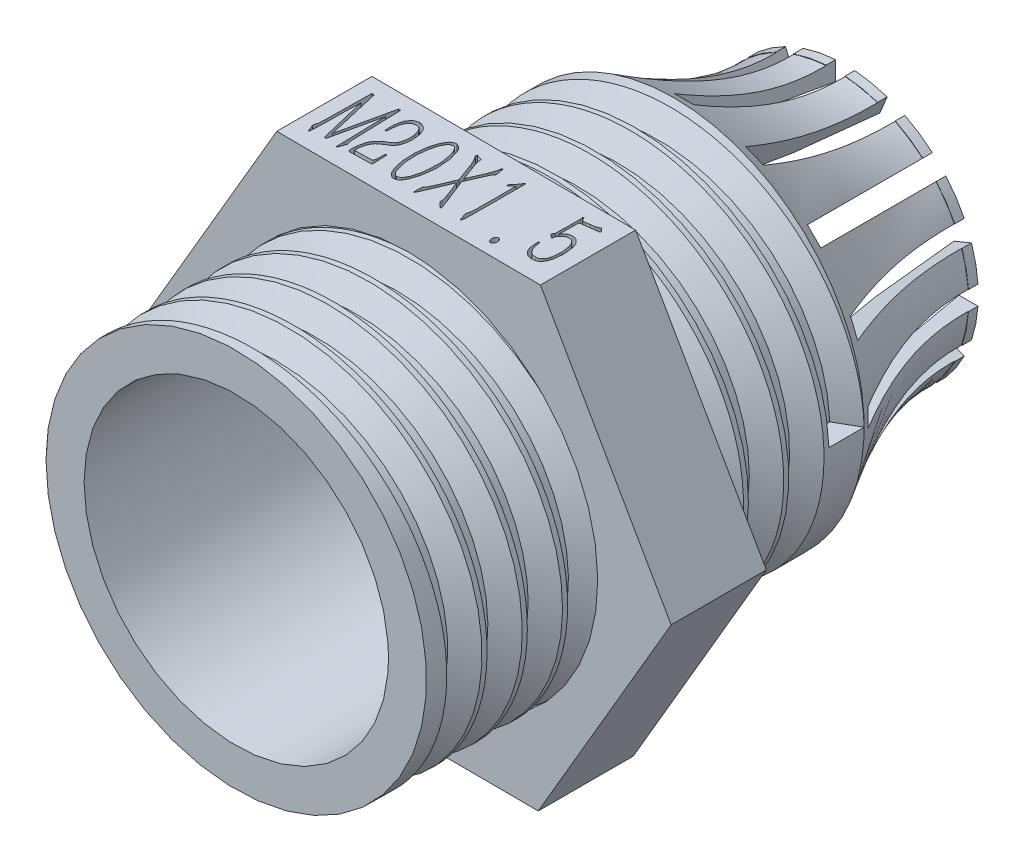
SolidWorks part; units mm, degrees
ref_plane "前视基准面" through (0, 0, 0) normal (0, 0, 1) x (1, 0, 0)
ref_plane "上视基准面" through (0, 0, 0) normal (0, 1, 0) x (1, 0, 0)
ref_plane "右视基准面" through (0, 0, 0) normal (1, 0, 0) x (0, 0, -1)
sketch "草图1" plane through (0, 0, 0) normal (0, 0, 1) x (1, 0, 0)
  line L1 (6.9868, 11.966) -> (-6.8694, 12.0338)
  line L2 (-6.8694, 12.0338) -> (-13.8562, 0.0678)
  line L3 (-13.8562, 0.0678) -> (-6.9868, -11.966)
  line L4 (-6.9868, -11.966) -> (6.8694, -12.0338)
  line L5 (6.8694, -12.0338) -> (13.8562, -0.0678)
  line L6 (13.8562, -0.0678) -> (6.9868, 11.966)
  circle A0 centre (0, 0) radius 12 construction
  point P1 (-0.0587, -11.9999)
  dimension "D1" = 24
extrude "凸台-拉伸1" add sketch "草图1" along normal blind 5
sketch "草图2" plane through (0, 0, 5) normal (0, 0, 1) x (1, 0, 0)
  circle A0 centre (0, 0) radius 10
extrude "拉伸-薄壁1" add sketch "草图2" along normal blind 9 thin
thread "螺纹线1" pitch 2.1167 start angle 0, offset 0, length 9, pitch 2.1167, diameter 20
ref_plane "基准面1" through (-10, 0, 14) normal (0, -1, 0) x (-1, 0, 0)
sketch "螺纹线轮廓1" plane through (-10, 0, 14) normal (0, -1, 0) x (-1, 0, 0)
  line L0 (0, 0) -> (0, 2.1167) construction
  line L11 (0, 0) -> (0, 1.8521)
  line L12 (0, 1.8521) -> (-1.1457, 1.1906)
  line L13 (-1.1457, 1.1906) -> (-1.1457, 0.6615)
  line L15 (-1.1457, 0.6615) -> (0, 0)
  line L17 (-1.1457, 0.926) -> (0, 0.926) construction
  point P2 (0, 0)
  dimension "Pitch" = 2.1167
  dimension "Profile_Angle" = 60
  dimension "Profile_Land" = 0.5292
  dimension "Profile_Height" = 1.1457
sketch "草图5" plane through (0, 0, 0) normal (0, 0, -1) x (-1, 0, 0)
  circle A0 centre (0, 0) radius 10
extrude "凸台-拉伸2" add sketch "草图5" along normal blind 9
thread "螺纹线2" pitch 2.1167 start angle 0, offset 0, length 9, pitch 2.1167, diameter 20
ref_plane "基准面2" through (10, 0, -9) normal (0, -1, 0) x (1, 0, 0)
sketch "螺纹线轮廓2" plane through (10, 0, -9) normal (0, -1, 0) x (1, 0, 0)
  line L0 (0, 0) -> (0, 2.1167) construction
  line L11 (0, 0) -> (0, 1.8521)
  line L12 (0, 1.8521) -> (-1.1457, 1.1906)
  line L13 (-1.1457, 1.1906) -> (-1.1457, 0.6615)
  line L15 (-1.1457, 0.6615) -> (0, 0)
  line L17 (-1.1457, 0.926) -> (0, 0.926) construction
  point P2 (0, 0)
  dimension "Pitch" = 2.1167
  dimension "Profile_Angle" = 60
  dimension "Profile_Land" = 0.5292
  dimension "Profile_Height" = 1.1457
sketch "草图10" plane through (0, 0, -9) normal (0, 0, -1) x (-1, 0, 0)
  circle A0 centre (0, 0) radius 8
extrude "切除-拉伸2" cut sketch "草图10" against normal through all
ref_plane "基准面3" through (0, 0, -18) normal (0, 0, -1) x (-1, 0, 0)
sketch "草图11" plane through (0, 0, -18) normal (0, 0, -1) x (-1, 0, 0)
  circle A0 centre (0, 0) radius 7
extrude "凸台-拉伸3" add sketch "草图11" against normal blind 0.5 separate body
loft "放样1" add
sketch "草图12" plane through (0, 0, 0) normal (0, 1, 0) x (1, 0, 0)
  line L2 (-0.5, 18) -> (0.5, 18)
  line L3 (0.5, 9.5382) -> (0.5, 18)
  line L4 (55, 18) -> (-55, 18) construction
  line L5 (-0.5, 9.5382) -> (-0.5, 18)
  line L7 (-0.5, 9.5382) -> (0.5, 9.5382)
extrude "切除-拉伸3" cut sketch "草图12" against normal through all both and the other way through all
pattern_circular "阵列(圆周)1" count 16 over 360 about axis through (0, 0, 0) along (0, 0, 1) of "切除-拉伸3"
sketch "草图13" plane through (0, 0, -18) normal (0, 0, -1) x (-1, 0, 0)
  circle A0 centre (0, 0) radius 6
extrude "切除-拉伸4" cut sketch "草图13" against normal blind 9 draft 10
sketch "草图14" plane through (0, 0, 0) normal (0, 1, 0) x (1, 0, 0)
  line L0 (0, 0) -> (0, 16.5956) construction
  line L2 (-8, 9) -> (-6.8156, 13.2709)
  line L3 (10, 9) -> (-10, 9) construction
  line L4 (-8, 9) -> (8, 9) construction
  line L5 (-6.8156, 13.2709) -> (0, 13.2709)
  line L6 (-8, 9) -> (0, 9)
  line L7 (-7.5869, 9) -> (7.5869, 9) construction
  line L8 (0, 13.2709) -> (0, 9)
  spline S0 degree 3 poles (-7.4753, 9.5382) (-7.0407, 11.9975) (-6.6059, 14.4569) (-6.1709, 16.9161) (-6.107, 17.2774) (-6.0431, 17.6387) (-5.9791, 18) knots 0.00945 0.00945 0.00945 0.00945 0.016942 0.016942 0.016942 0.018043 0.018043 0.018043 0.018043 construction
revolve "切除-旋转1" cut sketch "草图14" angle 360 about L0
sketch "草图15" plane through (0.0587, 11.9999, 0) normal (0.0049, 1, 0) x (1, -0.0049, 0)
  text T0 "M20X1.5"
extrude "切除-拉伸5" cut sketch "草图15" against normal blind 0.5
